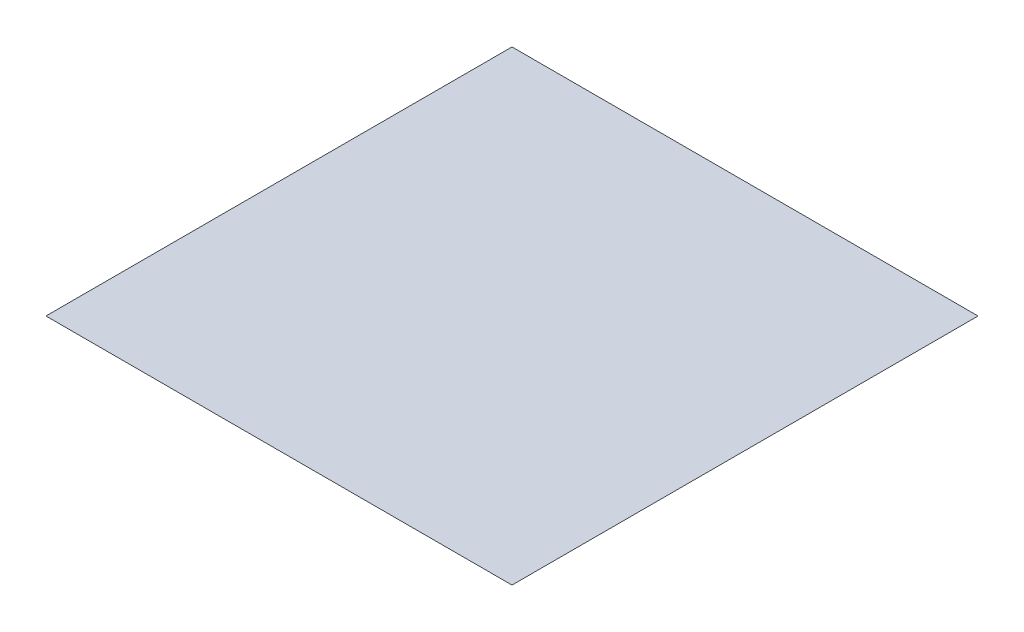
SolidWorks part; units mm, degrees
ref_plane "Vorne" through (0, 0, 0) normal (0, 0, 1) x (1, 0, 0)
ref_plane "Oben" through (0, 0, 0) normal (0, 1, 0) x (1, 0, 0)
ref_plane "Mitte" through (0, 0, 0) normal (1, 0, 0) x (0, 0, -1)
sketch "Panel" plane through (0, 0, 0) normal (0, 1, 0) x (1, 0, 0)
  line L0 (-50, -50) -> (50, 50) construction
  line L1 (-50, 50) -> (50, 50)
  line L2 (-50, 50) -> (-50, -50)
  line L3 (-50, -50) -> (50, -50)
  line L4 (50, 50) -> (50, -50)
  dimension "PanelWidth" = 100
  dimension "PanelLength" = 100
ref_plane "Tiefe" through (0, -3.175, 0) normal (0, 1, 0) x (-1, 0, 0)
sketch "Tiefenpunkt" plane through (0, -3.175, 0) normal (0, 1, 0) x (-1, 0, 0)
  point P0 (0, 0)
loft "Ausformung1" add profiles "Panel", "Tiefenpunkt"
fillet "Verrundung1" radius 0.3962 4 edges at (25, -1.5875, 25) (-25, -1.5875, 25) (-25, -1.5875, -25) (25, -1.5875, -25)
sketch "Orientierungs Skizze" plane through (0, 0, 0) normal (0, 1, 0) x (1, 0, 0)
  line L4 (-49.9749, -50) -> (49.9749, -50) construction
  line L5 (50, -49.9749) -> (50, 49.9749) construction
  line L6 (49.9749, 50) -> (-49.9749, 50) construction
  line L7 (-50, 49.9749) -> (-50, -49.9749) construction
  line L8 (-49.9749, -50) -> (49.9749, -50)
  line L9 (50, -49.9749) -> (50, 49.9749)
  line L10 (49.9749, 50) -> (-49.9749, 50)
  line L11 (-50, 49.9749) -> (-50, -49.9749)
  ellipse E4 centre (43.7474, -43.7474) end of major axis (37.5011, -37.5011) minor radius 0.3962 (49.9749, -50) -> (50, -49.9749) ccw construction
  ellipse E5 centre (43.7474, 43.7474) end of major axis (37.5011, 37.5011) minor radius 0.3962 (50, 49.9749) -> (49.9749, 50) ccw construction
  ellipse E6 centre (-43.7474, 43.7474) end of major axis (-37.5011, 37.5011) minor radius 0.3962 (-49.9749, 50) -> (-50, 49.9749) ccw construction
  ellipse E7 centre (-43.7474, -43.7474) end of major axis (-37.5011, -37.5011) minor radius 0.3962 (-50, -49.9749) -> (-49.9749, -50) ccw construction
  ellipse E8 centre (43.7474, -43.7474) end of major axis (37.5011, -37.5011) minor radius 0.3962 (49.9749, -50) -> (50, -49.9749) ccw
  ellipse E9 centre (43.7474, 43.7474) end of major axis (37.5011, 37.5011) minor radius 0.3962 (50, 49.9749) -> (49.9749, 50) ccw
  ellipse E10 centre (-43.7474, 43.7474) end of major axis (-37.5011, 37.5011) minor radius 0.3962 (-49.9749, 50) -> (-50, 49.9749) ccw
  ellipse E11 centre (-43.7474, -43.7474) end of major axis (-37.5011, -37.5011) minor radius 0.3962 (-50, -49.9749) -> (-49.9749, -50) ccw
other "FormTool1"
